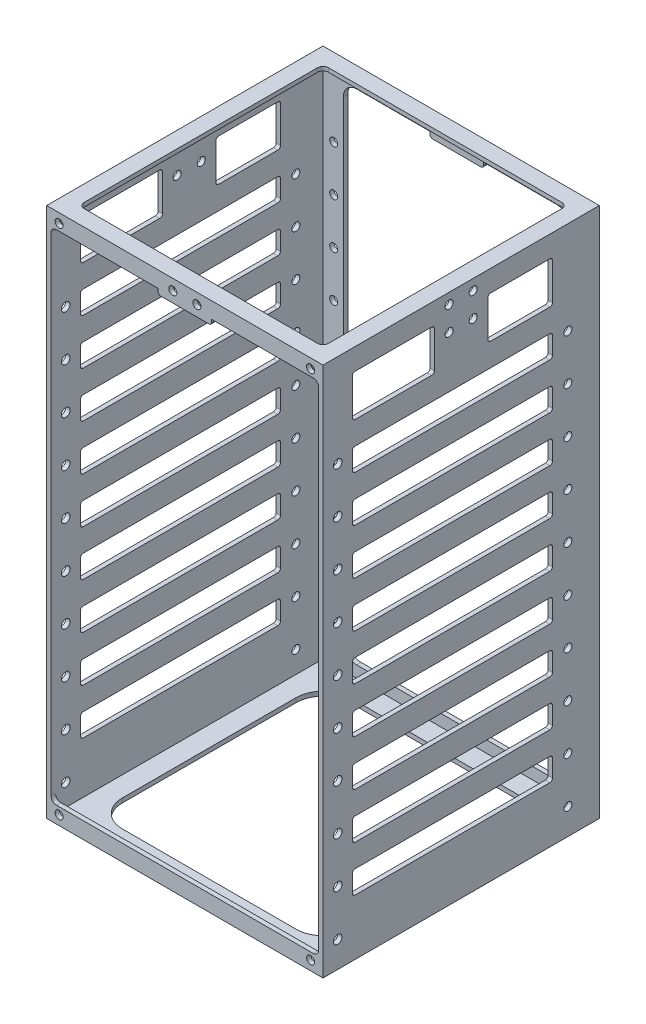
SolidWorks part; units mm, degrees
ref_plane "Front Plane" through (0, 0, 0) normal (0, 0, 1) x (1, 0, 0)
ref_plane "Top Plane" through (0, 0, 0) normal (0, 1, 0) x (1, 0, 0)
ref_plane "Right Plane" through (0, 0, 0) normal (1, 0, 0) x (0, 0, -1)
sketch "Sketch1" plane through (0, 0, 0) normal (0, 1, 0) x (1, 0, 0)
  line L1 (-51.63, -51.63) -> (51.63, -51.63)
  line L2 (-51.63, -51.63) -> (-51.63, 51.63)
  line L3 (-51.63, 51.63) -> (51.63, 51.63)
  line L4 (51.63, -51.63) -> (51.63, 51.63)
  line L5 (-51.63, -51.63) -> (51.63, 51.63) construction
  line L6 (-51.63, 51.63) -> (51.63, -51.63) construction
  line L7 (-32.5, -42.5) -> (32.5, -42.5)
  line L8 (-42.5, -32.5) -> (-42.5, 32.5)
  line L9 (-32.5, 42.5) -> (32.5, 42.5)
  line L10 (42.5, -32.5) -> (42.5, 32.5)
  line L11 (-42.5, -42.5) -> (42.5, 42.5) construction
  line L12 (-42.5, 42.5) -> (42.5, -42.5) construction
  arc A0 (32.5, -42.5) -> (42.5, -32.5) centre (32.5, -32.5) ccw
  arc A1 (32.5, 42.5) -> (42.5, 32.5) centre (32.5, 32.5) cw
  arc A2 (-42.5, 32.5) -> (-32.5, 42.5) centre (-32.5, 32.5) cw
  arc A3 (-32.5, -42.5) -> (-42.5, -32.5) centre (-32.5, -32.5) cw
  point P0 (0, 0)
  point P6 (0, 0)
  dimension "D3" = 10
  dimension "D1" = 103.26
  dimension "D2" = 42.5
extrude "Boss-Extrude2" add sketch "Sketch1" along normal blind 1.63 contours A3 L7 A0 L10 A1 L9 A2 L8 | L2 L1 L4 L3
sketch "Sketch3" plane through (0, 1.63, 0) normal (0, 1, 0) x (1, 0, 0)
  line L1 (-51.63, -51.63) -> (51.63, -51.63)
  line L2 (-51.63, -51.63) -> (-51.63, 51.63)
  line L3 (-51.63, 51.63) -> (51.63, 51.63)
  line L4 (51.63, -51.63) -> (51.63, 51.63)
  line L5 (-51.63, -51.63) -> (51.63, 51.63) construction
  line L6 (-51.63, 51.63) -> (51.63, -51.63) construction
  line L7 (-50, -50) -> (50, -50)
  line L8 (-50, -50) -> (-50, 50)
  line L9 (-50, 50) -> (50, 50)
  line L10 (50, -50) -> (50, 50)
  line L11 (-50, -50) -> (50, 50) construction
  line L12 (-50, 50) -> (50, -50) construction
  point P0 (0, 0)
  point P7 (0, 0)
  dimension "D1" = 100
extrude "Boss-Extrude3" add sketch "Sketch3" along normal blind 196.74 contours L8 L7 L10 L9 | L2 L3 L4 L1
sketch "Sketch4" plane through (0, 0, -51.63) normal (0, 0, 1) x (1, 0, 0)
  line L0 (-51.63, 0) -> (51.63, 0) construction
  line L1 (-37.38, 6) -> (37.38, 6)
  line L2 (-42.38, 11) -> (-42.38, 187.37)
  line L3 (-37.38, 192.37) -> (37.38, 192.37)
  line L4 (42.38, 11) -> (42.38, 187.37)
  line L5 (-42.38, 6) -> (42.38, 192.37) construction
  line L6 (-42.38, 192.37) -> (42.38, 6) construction
  line L7 (51.63, 198.37) -> (51.63, 0) construction
  line L8 (-50, 198.37) -> (50, 198.37) construction
  line L9 (-51.63, 198.37) -> (-51.63, 0) construction
  arc A0 (-37.38, 6) -> (-42.38, 11) centre (-37.38, 11) cw
  arc A1 (37.38, 6) -> (42.38, 11) centre (37.38, 11) ccw
  arc A2 (37.38, 192.37) -> (42.38, 187.37) centre (37.38, 187.37) cw
  arc A3 (-42.38, 187.37) -> (-37.38, 192.37) centre (-37.38, 187.37) cw
  point P0 (0, 99.185)
extrude "Cut-Extrude1" cut sketch "Sketch4" along normal up to surface (1.63 mm away)
sketch "Sketch5" plane through (0, 0, 51.63) normal (0, 0, 1) x (1, 0, 0)
  line L0 (-51.63, 198.37) -> (51.63, 198.37) construction
  line L1 (-48, 6.13) -> (48, 6.13)
  line L2 (-50, 8.13) -> (-50, 190.37)
  line L3 (-48, 192.37) -> (48, 192.37)
  line L4 (50, 8.13) -> (50, 190.37)
  line L5 (-50, 6.13) -> (50, 192.37) construction
  line L6 (-50, 192.37) -> (50, 6.13) construction
  line L7 (-51.63, 1.63) -> (51.63, 1.63) construction
  line L8 (-51.63, 198.37) -> (-51.63, 0) construction
  line L9 (51.63, 198.37) -> (51.63, 0) construction
  arc A0 (48, 6.13) -> (50, 8.13) centre (48, 8.13) ccw
  arc A1 (-48, 6.13) -> (-50, 8.13) centre (-48, 8.13) cw
  arc A2 (48, 192.37) -> (50, 190.37) centre (48, 190.37) cw
  arc A3 (-50, 190.37) -> (-48, 192.37) centre (-48, 190.37) cw
  point P0 (0, 99.25)
sketch "Sketch6" plane through (51.63, 0, 0) normal (1, 0, 0) x (0, 0, -1)
  line L0 (-51.63, 6.13) -> (-51.63, 192.37) construction
  line L2 (-51.63, 0) -> (51.63, 0) construction
  circle A0 centre (-46.13, 9.75) radius 1.6
  circle A1 centre (39.87, 9.75) radius 1.5
  circle A2 centre (-46.13, 26.85) radius 1.6
  circle A3 centre (39.87, 26.85) radius 1.5
  circle A4 centre (-46.13, 43.95) radius 1.6
  circle A5 centre (39.87, 43.95) radius 1.5
  circle A6 centre (-46.13, 61.05) radius 1.6
  circle A7 centre (39.87, 61.05) radius 1.5
  circle A8 centre (-46.13, 78.15) radius 1.6
  circle A9 centre (39.87, 78.15) radius 1.5
  circle A10 centre (-46.13, 95.25) radius 1.6
  circle A11 centre (39.87, 95.25) radius 1.5
  circle A12 centre (-46.13, 112.35) radius 1.6
  circle A13 centre (39.87, 112.35) radius 1.5
  circle A14 centre (-46.13, 129.45) radius 1.6
  circle A15 centre (39.87, 129.45) radius 1.5
  circle A16 centre (-46.13, 146.55) radius 1.6
  circle A17 centre (39.87, 146.55) radius 1.5
  circle A18 centre (-46.13, 163.65) radius 1.6
  circle A19 centre (39.87, 163.65) radius 1.5
  dimension "D4" = 3
  dimension "D5" = 3.2
  dimension "D1" = 5.5
  dimension "D2" = 86
  dimension "D3" = 9.75
  dimension "D7" = 17.1
  dimension "D9" = 17.1
  dimension "D6" = 9
  dimension "D8" = 2
extrude "Cut-Extrude2" cut sketch "Sketch6" against normal through all
extrude "Cut-Extrude3" cut sketch "Sketch5" against normal up to surface (1.63 mm away)
sketch "Sketch7" plane through (51.63, 0, 0) normal (1, 0, 0) x (0, 0, -1)
  line L0 (-40.63, 38.95) -> (-40.63, 45.45)
  line L1 (-39.63, 20.85) -> (33.12, 20.85)
  line L2 (-40.63, 21.85) -> (-40.63, 28.35)
  line L3 (-39.63, 29.35) -> (33.12, 29.35)
  line L4 (34.12, 21.85) -> (34.12, 28.35)
  line L5 (-40.63, 20.85) -> (34.12, 29.35) construction
  line L6 (-40.63, 29.35) -> (34.12, 20.85) construction
  line L7 (-40.63, 158.65) -> (-40.63, 165.15)
  line L8 (-39.63, 37.95) -> (33.12, 37.95)
  line L9 (34.12, 38.95) -> (34.12, 45.45)
  line L10 (-39.63, 46.45) -> (33.12, 46.45)
  line L11 (-40.63, 56.05) -> (-40.63, 62.55)
  line L12 (-39.63, 55.05) -> (33.12, 55.05)
  line L13 (34.12, 56.05) -> (34.12, 62.55)
  line L14 (-39.63, 63.55) -> (33.12, 63.55)
  line L15 (-40.63, 73.15) -> (-40.63, 79.65)
  line L16 (-39.63, 72.15) -> (33.12, 72.15)
  line L17 (34.12, 73.15) -> (34.12, 79.65)
  line L18 (-39.63, 80.65) -> (33.12, 80.65)
  line L19 (-40.63, 90.25) -> (-40.63, 96.75)
  line L20 (-39.63, 89.25) -> (33.12, 89.25)
  line L21 (34.12, 90.25) -> (34.12, 96.75)
  line L22 (-39.63, 97.75) -> (33.12, 97.75)
  line L23 (-40.63, 107.35) -> (-40.63, 113.85)
  line L24 (-39.63, 106.35) -> (33.12, 106.35)
  line L25 (34.12, 107.35) -> (34.12, 113.85)
  line L26 (-39.63, 114.85) -> (33.12, 114.85)
  line L27 (-40.63, 124.45) -> (-40.63, 130.95)
  line L28 (-39.63, 123.45) -> (33.12, 123.45)
  line L29 (34.12, 124.45) -> (34.12, 130.95)
  line L30 (-39.63, 131.95) -> (33.12, 131.95)
  line L31 (-40.63, 141.55) -> (-40.63, 148.05)
  line L32 (-39.63, 140.55) -> (33.12, 140.55)
  line L33 (34.12, 141.55) -> (34.12, 148.05)
  line L34 (-39.63, 149.05) -> (33.12, 149.05)
  line L35 (-39.63, 157.65) -> (33.12, 157.65)
  line L36 (34.12, 158.65) -> (34.12, 165.15)
  line L37 (-39.63, 166.15) -> (33.12, 166.15)
  line L38 (-40.63, 141.55) -> (-40.63, 158.65) construction
  circle A0 centre (-46.13, 9.75) radius 1.6 construction
  arc A1 (33.12, 29.35) -> (34.12, 28.35) centre (33.12, 28.35) cw
  arc A2 (33.12, 20.85) -> (34.12, 21.85) centre (33.12, 21.85) ccw
  arc A3 (-39.63, 20.85) -> (-40.63, 21.85) centre (-39.63, 21.85) cw
  arc A4 (-40.63, 28.35) -> (-39.63, 29.35) centre (-39.63, 28.35) cw
  arc A5 (-40.63, 45.45) -> (-39.63, 46.45) centre (-39.63, 45.45) cw
  arc A6 (-39.63, 37.95) -> (-40.63, 38.95) centre (-39.63, 38.95) cw
  arc A7 (33.12, 37.95) -> (34.12, 38.95) centre (33.12, 38.95) ccw
  arc A8 (33.12, 46.45) -> (34.12, 45.45) centre (33.12, 45.45) cw
  arc A9 (-40.63, 62.55) -> (-39.63, 63.55) centre (-39.63, 62.55) cw
  arc A10 (-39.63, 55.05) -> (-40.63, 56.05) centre (-39.63, 56.05) cw
  arc A11 (33.12, 55.05) -> (34.12, 56.05) centre (33.12, 56.05) ccw
  arc A12 (33.12, 63.55) -> (34.12, 62.55) centre (33.12, 62.55) cw
  arc A13 (-40.63, 79.65) -> (-39.63, 80.65) centre (-39.63, 79.65) cw
  arc A14 (-39.63, 72.15) -> (-40.63, 73.15) centre (-39.63, 73.15) cw
  arc A15 (33.12, 72.15) -> (34.12, 73.15) centre (33.12, 73.15) ccw
  arc A16 (33.12, 80.65) -> (34.12, 79.65) centre (33.12, 79.65) cw
  arc A17 (-40.63, 96.75) -> (-39.63, 97.75) centre (-39.63, 96.75) cw
  arc A18 (-39.63, 89.25) -> (-40.63, 90.25) centre (-39.63, 90.25) cw
  arc A19 (33.12, 89.25) -> (34.12, 90.25) centre (33.12, 90.25) ccw
  arc A20 (33.12, 97.75) -> (34.12, 96.75) centre (33.12, 96.75) cw
  arc A21 (-40.63, 113.85) -> (-39.63, 114.85) centre (-39.63, 113.85) cw
  arc A22 (-39.63, 106.35) -> (-40.63, 107.35) centre (-39.63, 107.35) cw
  arc A23 (33.12, 106.35) -> (34.12, 107.35) centre (33.12, 107.35) ccw
  arc A24 (33.12, 114.85) -> (34.12, 113.85) centre (33.12, 113.85) cw
  arc A25 (-40.63, 130.95) -> (-39.63, 131.95) centre (-39.63, 130.95) cw
  arc A26 (-39.63, 123.45) -> (-40.63, 124.45) centre (-39.63, 124.45) cw
  arc A27 (33.12, 123.45) -> (34.12, 124.45) centre (33.12, 124.45) ccw
  arc A28 (33.12, 131.95) -> (34.12, 130.95) centre (33.12, 130.95) cw
  arc A29 (-40.63, 148.05) -> (-39.63, 149.05) centre (-39.63, 148.05) cw
  arc A30 (-39.63, 140.55) -> (-40.63, 141.55) centre (-39.63, 141.55) cw
  arc A31 (33.12, 140.55) -> (34.12, 141.55) centre (33.12, 141.55) ccw
  arc A32 (33.12, 149.05) -> (34.12, 148.05) centre (33.12, 148.05) cw
  arc A33 (-40.63, 165.15) -> (-39.63, 166.15) centre (-39.63, 165.15) cw
  arc A34 (-39.63, 157.65) -> (-40.63, 158.65) centre (-39.63, 158.65) cw
  circle A35 centre (39.87, 9.75) radius 1.5 construction
  arc A36 (33.12, 157.65) -> (34.12, 158.65) centre (33.12, 158.65) ccw
  arc A37 (33.12, 166.15) -> (34.12, 165.15) centre (33.12, 165.15) cw
  point P0 (-3.255, 25.1)
  dimension "D5" = 1
  dimension "D3" = 5.75
  dimension "D1" = 8.5
  dimension "D2" = 11.1
  dimension "D4" = 5.5
  dimension "D7" = 8.6
  dimension "D9" = 8.6
  dimension "D6" = 8
  dimension "D8" = 2
extrude "Cut-Extrude4" cut sketch "Sketch7" against normal through all
sketch "Sketch8" plane through (51.63, 0, 0) normal (1, 0, 0) x (0, 0, -1)
  line L7 (-51.63, 198.37) -> (51.63, 198.37) construction
  line L15 (-39.63, 190.37) -> (33.12, 190.37)
  line L16 (-40.63, 189.37) -> (-40.63, 175.75)
  line L17 (-39.63, 174.75) -> (33.12, 174.75)
  line L18 (34.12, 189.37) -> (34.12, 175.75)
  line L19 (33.12, 166.15) -> (-39.63, 166.15) construction
  arc A15 (33.12, 190.37) -> (34.12, 189.37) centre (33.12, 189.37) cw
  arc A16 (33.12, 174.75) -> (34.12, 175.75) centre (33.12, 175.75) ccw
  arc A17 (-40.63, 175.75) -> (-39.63, 174.75) centre (-39.63, 175.75) ccw
  arc A18 (-39.63, 190.37) -> (-40.63, 189.37) centre (-39.63, 189.37) ccw
  circle A19 centre (-46.13, 163.65) radius 1.6 construction
  circle A20 centre (39.87, 163.65) radius 1.5 construction
  point P0 (-2.625, 162.85)
  dimension "D6" = 1
  dimension "D2" = 8.6
  dimension "D8" = 8
  dimension "D9" = 5.5
  dimension "D10" = 5.75
extrude "Cut-Extrude5" cut sketch "Sketch8" against normal through all
sketch "Sketch15" plane through (51.63, 0, 0) normal (1, 0, 0) x (0, 0, -1)
  line L0 (-50, 198.37) -> (-50, 190.37) construction
  line L7 (33.12, 190.37) -> (-39.63, 190.37) construction
  line L8 (-10, 190.37) -> (10, 190.37)
  line L9 (-10, 190.37) -> (-10, 174.75)
  line L10 (-10, 174.75) -> (10, 174.75)
  line L11 (10, 190.37) -> (10, 174.75)
  line L12 (-39.63, 174.75) -> (33.12, 174.75) construction
  dimension "D1" = 20
  dimension "D2" = 40
extrude "Boss-Extrude4" add sketch "Sketch15" against normal up to surface (1.63 mm away)
sketch "Sketch16" plane through (-51.63, 0, 0) normal (-1, 0, 0) x (0, 0, 1)
  line L7 (-10, 190.37) -> (10, 190.37)
  line L8 (-10, 190.37) -> (-10, 174.75)
  line L9 (-10, 174.75) -> (10, 174.75)
  line L10 (10, 190.37) -> (10, 174.75)
extrude "Boss-Extrude5" add sketch "Sketch16" against normal up to surface (1.63 mm away)
sketch "Sketch9" plane through (51.63, 0, 0) normal (1, 0, 0) x (0, 0, -1)
  line L0 (-51.63, 198.37) -> (51.63, 198.37) construction
  line L2 (-11.0428, 189.87) -> (9.2919, 189.87) construction
  line L3 (-50, 198.37) -> (-50, 190.37) construction
  circle A0 centre (-4.5, 194.37) radius 1.5
  circle A1 centre (4.5, 194.37) radius 1.5
  circle A2 centre (4.5, 185.37) radius 1.5
  circle A3 centre (-4.5, 185.37) radius 1.5
  dimension "D1" = 3
  dimension "D3" = 9
  dimension "D5" = 3
  dimension "D2" = 4
  dimension "D4" = 45.5
  dimension "D6" = 4.5
extrude "Cut-Extrude6" cut sketch "Sketch9" against normal through all
fillet "Fillet1" radius 1 8 edges at (-50.815, 174.75, 10) (-50.815, 190.37, 10) (-50.815, 190.37, -10) (-50.815, 174.75, -10) (50.815, 190.37, 10) (50.815, 174.75, 10) (50.815, 174.75, -10) (50.815, 190.37, -10)
sketch "Sketch18" plane through (0, 0, -51.63) normal (0, 0, -1) x (-1, 0, 0)
  line L0 (-37.38, 192.37) -> (37.38, 192.37) construction
  line L1 (-10, 192.37) -> (10, 192.37)
  line L2 (-10, 192.37) -> (-10, 191.37)
  line L3 (-9, 190.37) -> (9, 190.37)
  line L4 (10, 192.37) -> (10, 191.37)
  line L6 (-50, 198.37) -> (-50, 1.63) construction
  arc A0 (9, 190.37) -> (10, 191.37) centre (9, 191.37) ccw
  arc A1 (-10, 191.37) -> (-9, 190.37) centre (-9, 191.37) ccw
  point P4 (-10, 191.87)
  dimension "D3" = 1
  dimension "D1" = 2
  dimension "D2" = 20
  dimension "D4" = 40
extrude "Boss-Extrude7" add sketch "Sketch18" against normal up to surface (1.63 mm away)
sketch "Sketch17" plane through (0, 0, 51.63) normal (0, 0, 1) x (1, 0, 0)
  line L0 (48, 192.37) -> (-48, 192.37) construction
  line L1 (-10, 192.37) -> (10, 192.37)
  line L2 (-10, 192.37) -> (-10, 191.37)
  line L3 (-9, 190.37) -> (9, 190.37)
  line L4 (10, 192.37) -> (10, 191.37)
  line L5 (-50, 198.37) -> (-50, 190.37) construction
  arc A0 (9, 190.37) -> (10, 191.37) centre (9, 191.37) ccw
  arc A1 (-10, 191.37) -> (-9, 190.37) centre (-9, 191.37) ccw
  dimension "D4" = 1
  dimension "D1" = 20
  dimension "D2" = 40
  dimension "D3" = 2
extrude "Boss-Extrude6" add sketch "Sketch17" against normal up to surface (1.63 mm away)
sketch "Sketch19" plane through (0, 0, 51.63) normal (0, 0, 1) x (1, 0, 0)
  line L0 (0, 198.37) -> (0, 190.37) construction
  line L1 (-9, 190.37) -> (9, 190.37) construction
  line L3 (-51.63, 198.37) -> (51.63, 198.37) construction
  circle A0 centre (-4.5, 194.37) radius 1.5
  circle A1 centre (4.5, 194.37) radius 1.5
  dimension "D1" = 3
  dimension "D2" = 4
  dimension "D3" = 4.5
extrude "Cut-Extrude7" cut sketch "Sketch19" against normal through all
sketch "Sketch20" plane through (0, 0, 51.63) normal (0, 0, 1) x (1, 0, 0)
  line L1 (-51.63, 0) -> (51.63, 0) construction
  line L2 (0, 198.37) -> (0, 0) construction
  line L3 (-51.63, 198.37) -> (51.63, 198.37) construction
  line L4 (-50, 198.37) -> (-50, 190.37) construction
  line L5 (-50, 8.13) -> (-50, 1.63) construction
  circle A0 centre (-46.98, 3.5) radius 1.5
  circle A1 centre (-46.98, 194.87) radius 1.5
  circle A2 centre (46.98, 3.5) radius 1.5
  circle A3 centre (46.98, 194.87) radius 1.5
  dimension "D1" = 3
  dimension "D4" = 3
  dimension "D2" = 3.02
  dimension "D3" = 3.5
  dimension "D5" = 3.02
  dimension "D6" = 3.5
extrude "Cut-Extrude8" cut sketch "Sketch20" against normal up to surface (1.63 mm away)
sketch "Sketch23" plane through (0, 0, -51.63) normal (0, 0, -1) x (-1, 0, 0)
  line L0 (-51.63, 198.37) -> (-51.63, 0) construction
  line L1 (51.63, 0) -> (-51.63, 0) construction
  line L2 (0, 198.37) -> (0, 0) construction
  line L3 (51.63, 198.37) -> (-51.63, 198.37) construction
  circle A0 centre (-46, 17.05) radius 1.5
  circle A2 centre (-46, 34.15) radius 1.5
  circle A3 centre (-46, 51.25) radius 1.5
  circle A4 centre (-46, 68.35) radius 1.5
  circle A5 centre (-46, 85.45) radius 1.5
  circle A6 centre (-46, 102.55) radius 1.5
  circle A7 centre (-46, 119.65) radius 1.5
  circle A8 centre (-46, 136.75) radius 1.5
  circle A9 centre (-46, 153.85) radius 1.5
  circle A10 centre (-46, 170.95) radius 1.5
  circle A11 centre (46, 170.95) radius 1.5
  circle A12 centre (46, 153.85) radius 1.5
  circle A13 centre (46, 136.75) radius 1.5
  circle A14 centre (46, 119.65) radius 1.5
  circle A15 centre (46, 102.55) radius 1.5
  circle A16 centre (46, 85.45) radius 1.5
  circle A17 centre (46, 68.35) radius 1.5
  circle A18 centre (46, 51.25) radius 1.5
  circle A19 centre (46, 34.15) radius 1.5
  circle A20 centre (46, 17.05) radius 1.5
  dimension "D1" = 3
  dimension "D2" = 5.63
  dimension "D3" = 17.05
  dimension "D5" = 17.1
  dimension "D4" = 10
extrude "Cut-Extrude10" cut sketch "Sketch23" against normal up to surface (1.63 mm away)
sketch "Sketch25" plane through (0, 198.37, 0) normal (0, 1, 0) x (1, 0, 0)
  line L1 (-50, -50) -> (50, -50)
  line L2 (-50, -50) -> (-50, 50)
  line L3 (-50, 50) -> (50, 50)
  line L4 (50, -50) -> (50, 50)
  line L5 (-50, -50) -> (50, 50) construction
  line L6 (-50, 50) -> (50, -50) construction
  point P0 (0, 0)
extrude "Boss-Extrude8" add sketch "Sketch25" against normal blind 1.5
sketch "Sketch26" plane through (0, 198.37, 0) normal (0, 1, 0) x (1, 0, 0)
  line L0 (-51.63, -51.63) -> (-51.63, 51.63) construction
  line L1 (-43.63, -45.63) -> (43.63, -45.63)
  line L2 (-45.63, -43.63) -> (-45.63, 43.63)
  line L3 (-43.63, 45.63) -> (43.63, 45.63)
  line L4 (45.63, -43.63) -> (45.63, 43.63)
  line L5 (-45.63, -45.63) -> (45.63, 45.63) construction
  line L6 (-45.63, 45.63) -> (45.63, -45.63) construction
  arc A0 (-45.63, 43.63) -> (-43.63, 45.63) centre (-43.63, 43.63) cw
  arc A1 (43.63, 45.63) -> (45.63, 43.63) centre (43.63, 43.63) cw
  arc A2 (43.63, -45.63) -> (45.63, -43.63) centre (43.63, -43.63) ccw
  arc A3 (-43.63, -45.63) -> (-45.63, -43.63) centre (-43.63, -43.63) cw
  point P0 (0, 0)
  dimension "D2" = 2
  dimension "D1" = 6
extrude "Cut-Extrude11" cut sketch "Sketch26" against normal up to surface (1.5 mm away)
equation "\"D2@Sketch4\"=\"D4@Sketch4\""
equation "\"D4@Sketch5\"=\"D3@Sketch5\""
